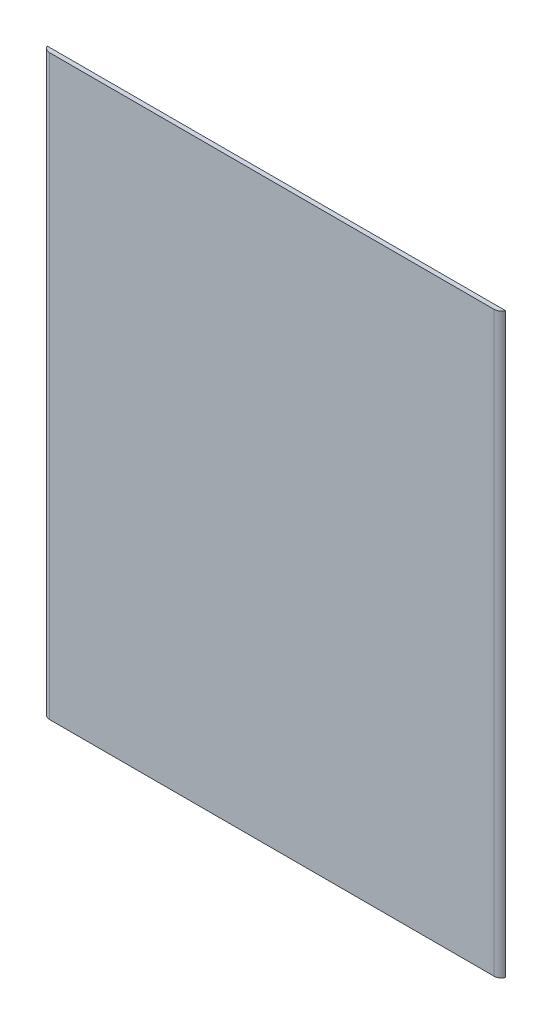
SolidWorks part; units mm, degrees
ref_plane "Plano frontal" through (0, 0, 0) normal (0, 0, 1) x (1, 0, 0)
ref_plane "Plano superior" through (0, 0, 0) normal (0, 1, 0) x (1, 0, 0)
ref_plane "Plano direito" through (0, 0, 0) normal (1, 0, 0) x (0, 0, -1)
sketch "Esboço1" plane through (0, 0, 0) normal (0, 0, 1) x (1, 0, 0)
  line L1 (0, 0) -> (600, 0)
  line L2 (0, 0) -> (0, -750)
  line L3 (0, -750) -> (600, -750)
  line L4 (600, 0) -> (600, -750)
  dimension "D1" = 600
  dimension "D2" = 750
extrude "Ressalto-extrusão3" add sketch "Esboço1" along normal blind 6
fillet "Filete4" radius 10 1 edges at (600, -375, 6)
fillet "Filete5" radius 10 1 edges at (0, -375, 6)
sketch "Esboço2" plane through (0, 0, 0) normal (0, 1, 0) x (1, 0, 0)
  line L0 (0, 0) -> (600, 0)
  line L1 (600, 0) -> (0, 0) construction
  line L2 (590.8348, -6) -> (9.1652, -6)
  line L3 (590.8348, -6) -> (9.1652, -6) construction
  line L5 (590.8348, -6) -> (172.2218, -6)
  arc A0 (590.8348, -6) -> (600, 0) centre (590.8348, 4) ccw construction
  arc A1 (0, 0) -> (9.1652, -6) centre (9.1652, 4) ccw construction
  arc A2 (0, 0) -> (9.1652, -6) centre (9.1652, 4) ccw
  arc A3 (590.8348, -6) -> (600, 0) centre (590.8348, 4) ccw
extrude "Ressalto-extrusão4" add sketch "Esboço2" along normal blind 6 contours L2 M6 M3 M4 M5
